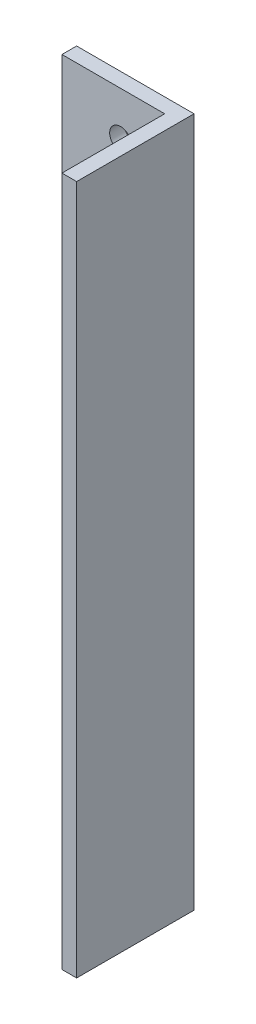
SolidWorks part; units mm, degrees
ref_plane "Front Plane" through (0, 0, 0) normal (0, 0, 1) x (1, 0, 0)
ref_plane "Top Plane" through (0, 0, 0) normal (0, 1, 0) x (1, 0, 0)
ref_plane "Right Plane" through (0, 0, 0) normal (1, 0, 0) x (0, 0, -1)
sketch "Sketch1" plane through (0, 0, 0) normal (0, 1, 0) x (1, 0, 0)
  line L0 (-9.525, 9.525) -> (9.525, 9.525)
  line L1 (9.525, -12.7) -> (12.7, -12.7)
  line L2 (-12.7, 9.525) -> (-12.7, 12.7)
  line L3 (-12.7, 12.7) -> (12.7, 12.7)
  line L4 (12.7, -12.7) -> (12.7, 12.7)
  line L5 (-12.7, -12.7) -> (12.7, 12.7) construction
  line L6 (-12.7, 12.7) -> (12.7, -12.7) construction
  line L7 (9.525, -9.525) -> (9.525, 9.525)
  line L10 (-9.525, 9.525) -> (-12.7, 9.525)
  line L11 (9.525, -9.525) -> (9.525, -12.7)
  line L12 (-12.7, -12.7) -> (12.7, -12.7) construction
  line L13 (-12.7, -12.7) -> (-12.7, 12.7) construction
  line L14 (-9.525, -9.525) -> (-9.525, 9.525) construction
  line L15 (-9.525, -9.525) -> (9.525, -9.525) construction
  point P1 (0, 0)
  dimension "D2" = 25.4
  dimension "D1" = 3.175
extrude "Boss-Extrude1" add sketch "Sketch1" along normal mid plane 149.225
sketch "Sketch2" plane through (0, 0, -12.7) normal (0, 0, -1) x (-1, 0, 0)
  line L0 (0, 74.6125) -> (0, -74.6125) construction
  line L1 (-12.7, 74.6125) -> (12.7, 74.6125) construction
  line L2 (-12.7, -74.6125) -> (12.7, -74.6125) construction
  circle A0 centre (0, 65.0875) radius 2.3812
  dimension "D2" = 4.7625
  dimension "D1" = 9.525
extrude "Cut-Extrude1" cut sketch "Sketch2" against normal through all
pattern_linear "LPattern1" count 4 spacing 25.4 along (0, -1, 0) of "Cut-Extrude1"
